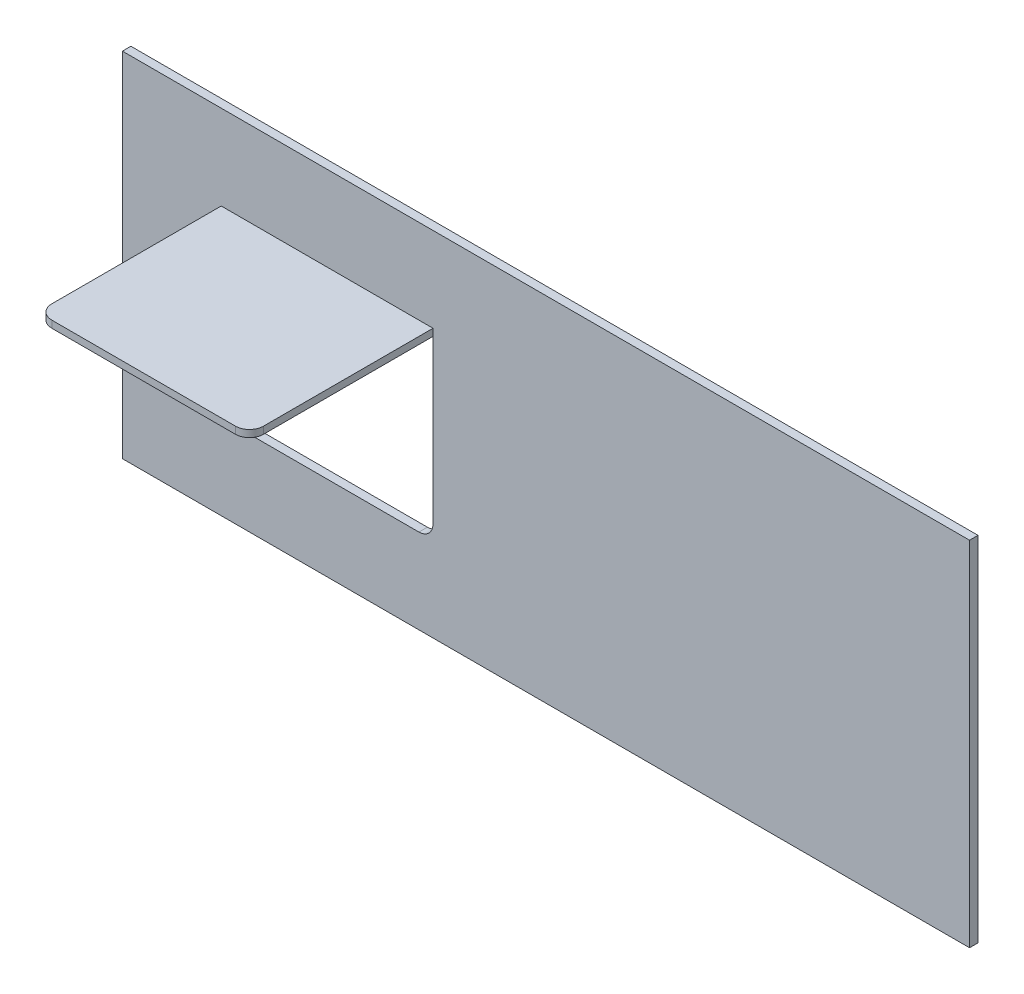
SolidWorks part; units mm, degrees
ref_plane "Plano frontal" through (0, 0, 0) normal (0, 0, 1) x (1, 0, 0)
ref_plane "Plano superior" through (0, 0, 0) normal (0, 1, 0) x (1, 0, 0)
ref_plane "Plano direito" through (0, 0, 0) normal (1, 0, 0) x (0, 0, -1)
sketch "Esboço1" plane through (0, 0, 0) normal (0, 0, 1) x (1, 0, 0)
  line L1 (0, 0) -> (600, 0)
  line L2 (0, 0) -> (0, -250)
  line L3 (0, -250) -> (600, -250)
  line L4 (600, 0) -> (600, -250)
  line L5 (70, -60) -> (220, -60)
  line L6 (70, -60) -> (70, -190)
  line L7 (70, -190) -> (220, -190)
  line L8 (220, -60) -> (220, -190)
  dimension "D1" = 600
  dimension "D2" = 250
  dimension "D3" = 60
  dimension "D4" = 130
  dimension "D5" = 70
  dimension "D6" = 150
extrude "Ressalto-extrusão1" add sketch "Esboço1" along normal blind 6 contours L2 L1 L4 L3
sketch "Esboço7" plane through (0, 0, 6) normal (0, 0, 1) x (1, 0, 0)
  line L0 (0, 0) -> (600, 0) construction
  line L1 (70, -60) -> (220, -60)
  line L2 (70, -60) -> (70, -190)
  line L3 (70, -190) -> (220, -190)
  line L4 (220, -60) -> (220, -190)
  line L5 (0, 0) -> (0, -250) construction
  dimension "D1" = 150
  dimension "D2" = 130
  dimension "D3" = 60
  dimension "D4" = 70
extrude "Corte-extrusão6" cut sketch "Esboço7" against normal blind 215 contours L2 L1 L4 L3
sketch "Esboço8" plane through (0, -60, 0) normal (0, -1, 0) x (1, 0, 0)
  line L1 (70, 6) -> (220, 6)
  line L2 (70, 6) -> (70, 136)
  line L3 (70, 136) -> (220, 136)
  line L4 (220, 6) -> (220, 136)
  dimension "D1" = 150
  dimension "D2" = 130
extrude "Ressalto-extrusão2" add sketch "Esboço8" along normal blind 5 separate body
fillet "Filete5" radius 10 1 edges at (70, -190, 3)
fillet "Filete6" radius 10 1 edges at (220, -190, 3)
fillet "Filete7" radius 10 1 edges at (220, -62.5, 136)
fillet "Filete8" radius 10 1 edges at (70, -62.5, 136)
